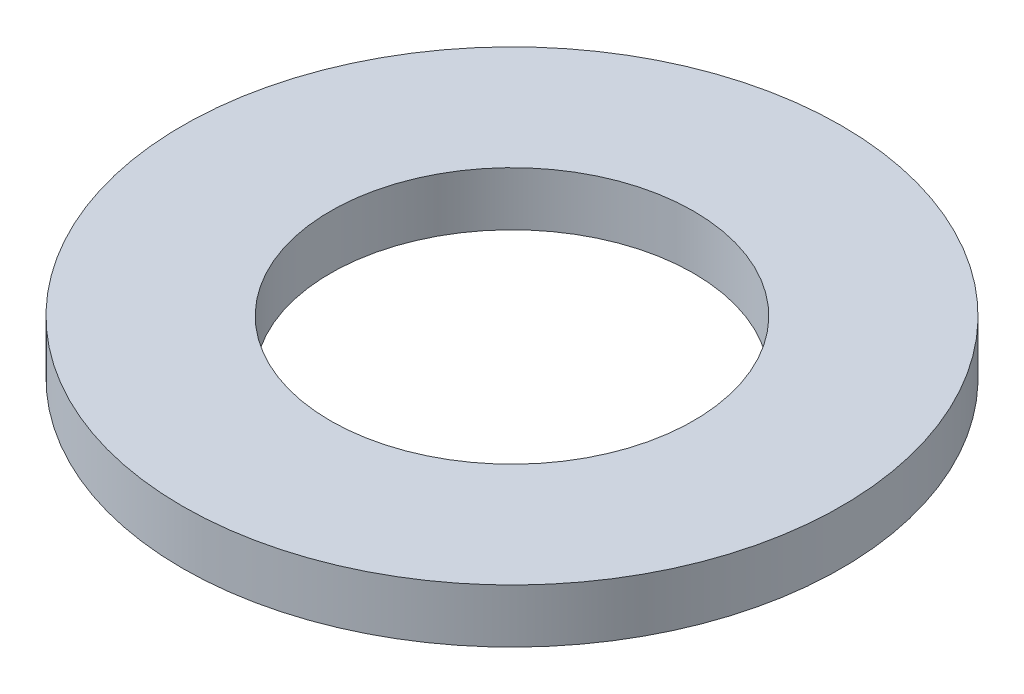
SolidWorks part; units mm, degrees
ref_plane "Front" through (0, 0, 0) normal (0, 0, 1) x (1, 0, 0)
ref_plane "Top" through (0, 0, 0) normal (0, 1, 0) x (1, 0, 0)
ref_plane "Right" through (0, 0, 0) normal (1, 0, 0) x (0, 0, -1)
sketch "Sketch1" plane through (0, 0, 0) normal (0, 1, 0) x (1, 0, 0)
  circle A0 centre (0, 0) radius 27
  circle A1 centre (0, 0) radius 49
extrude "Extrude1" add sketch "Sketch1" along normal blind 8
